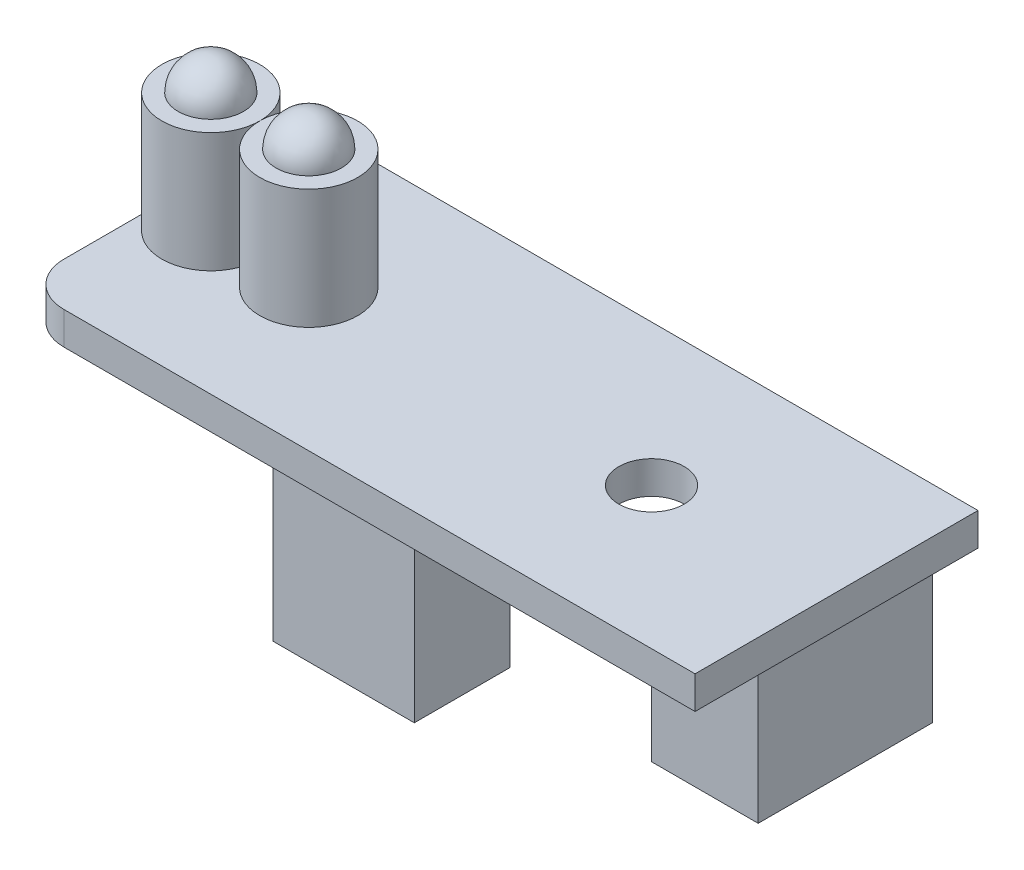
SolidWorks part; units mm, degrees
ref_plane "前视基准面" through (0, 0, 0) normal (0, 0, 1) x (1, 0, 0)
ref_plane "上视基准面" through (0, 0, 0) normal (0, 1, 0) x (1, 0, 0)
ref_plane "右视基准面" through (0, 0, 0) normal (1, 0, 0) x (0, 0, -1)
sketch "草图1" plane through (0, 0, 0) normal (0, 1, 0) x (1, 0, 0)
  line L1 (-15.5, 6.5) -> (15.5, 6.5)
  line L2 (-15.5, 6.5) -> (-15.5, -6.5)
  line L3 (-15.5, -6.5) -> (15.5, -6.5)
  line L4 (15.5, 6.5) -> (15.5, -6.5)
  line L5 (-15.5, 6.5) -> (15.5, -6.5) construction
  line L6 (-15.5, -6.5) -> (15.5, 6.5) construction
  point P0 (0, 0)
extrude "凸台-拉伸1" add sketch "草图1" along normal blind 1.5
fillet "圆角1" radius 2 2 edges at (-15.5, 0.75, 6.5) (-15.5, 0.75, -6.5)
sketch "草图2" plane through (0, 1.5, 0) normal (0, 1, 0) x (1, 0, 0)
  line L0 (-15.5, 0) -> (15.5, 0) construction
  line L1 (-15.5, 4.5) -> (-15.5, -4.5) construction
  line L2 (15.5, -6.5) -> (15.5, 6.5) construction
  circle A0 centre (-13.25, 0) radius 2.25
  circle A1 centre (-8.75, 0) radius 2.25
extrude "凸台-拉伸3" add sketch "草图2" along normal blind 5.5 separate body contours A0 L0 | L0 A0 | L0 A1 | A1 L0
sketch "草图3" plane through (0, 7, 0) normal (0, 1, 0) x (1, 0, 0)
  line L0 (-13.25, 1.5) -> (-13.25, -1.5)
  arc A0 (-13.25, 1.5) -> (-13.25, -1.5) centre (-13.25, 0) ccw
revolve "旋转1" add sketch "草图3" angle 360 about L0
sketch "草图4" plane through (0, 7, 0) normal (0, 1, 0) x (1, 0, 0)
  line L0 (-8.75, 1.5) -> (-8.75, -1.5)
  arc A0 (-8.75, 1.5) -> (-8.75, -1.5) centre (-8.75, 0) ccw
revolve "旋转2" add sketch "草图4" angle 360 about L0
sketch "草图5" plane through (0, 0, 0) normal (0, -1, 0) x (-1, 0, 0)
  line L0 (-15.5, -6.5) -> (-15.5, 6.5) construction
  circle A0 centre (-7, 0) radius 1.5
  dimension "D1" = 8.5
extrude "切除-拉伸1" cut sketch "草图5" against normal blind 5.5
sketch "草图6" plane through (0, 0, 0) normal (0, -1, 0) x (1, 0, 0)
  line L0 (-13.5, 6.5) -> (15.5, 6.5) construction
  line L1 (-4, 2) -> (2.5, 2)
  line L2 (-4, 2) -> (-4, 6.5)
  line L3 (-4, 6.5) -> (2.5, 6.5)
  line L4 (2.5, 2) -> (2.5, 6.5)
  line L5 (-4, 2) -> (2.5, 6.5) construction
  line L6 (-4, 6.5) -> (2.5, 2) construction
  line L7 (-15.5, -4.5) -> (-15.5, 4.5) construction
  point P0 (-0.75, 4.25)
  dimension "D1" = 18
extrude "凸台-拉伸4" add sketch "草图6" along normal blind 7
sketch "草图7" plane through (0, 0, 0) normal (0, -1, 0) x (1, 0, 0)
  line L0 (-15.5, -4.5) -> (-15.5, 4.5) construction
  line L1 (-3, -0.1059) -> (1, -0.1059)
  line L2 (-3, -0.1059) -> (-3, -5.1059)
  line L3 (-3, -5.1059) -> (1, -5.1059)
  line L4 (1, -0.1059) -> (1, -5.1059)
  line L5 (-3, -0.1059) -> (1, -5.1059) construction
  line L6 (-3, -5.1059) -> (1, -0.1059) construction
  point P0 (-1, -2.6059)
  dimension "D1" = 16.5
extrude "凸台-拉伸5" add sketch "草图7" along normal blind 1.5
sketch "草图8" plane through (0, 0, 0) normal (0, -1, 0) x (1, 0, 0)
  line L0 (15.5, 6.5) -> (15.5, -6.5) construction
  line L1 (10.5, 3.5) -> (15.5, 3.5)
  line L2 (10.5, 3.5) -> (10.5, -4.5)
  line L3 (10.5, -4.5) -> (15.5, -4.5)
  line L4 (15.5, 3.5) -> (15.5, -4.5)
  line L5 (10.5, 3.5) -> (15.5, -4.5) construction
  line L6 (10.5, -4.5) -> (15.5, 3.5) construction
  line L7 (15.5, -6.5) -> (-13.5, -6.5) construction
  point P0 (13, -0.5)
  dimension "D1" = 10
extrude "凸台-拉伸6" add sketch "草图8" along normal blind 6
sketch "草图9" plane through (0, -6, 0) normal (0, -1, 0) x (1, 0, 0)
  line L0 (10.5, -0.5) -> (15.5, -0.5) construction
  line L1 (10.5, 3.5) -> (10.5, -4.5) construction
  line L2 (15.5, -4.5) -> (15.5, 3.5) construction
  line L3 (10.5, -4.5) -> (15.5, -4.5) construction
  line L4 (11, 3) -> (15, 3)
  line L5 (11, 3) -> (11, -4)
  line L6 (11, -4) -> (15, -4)
  line L7 (15, 3) -> (15, -4)
  line L8 (11, 3) -> (15, -4) construction
  line L9 (11, -4) -> (15, 3) construction
  point P6 (13, -0.5)
  dimension "D1" = 0.5
  dimension "D2" = 0.5
extrude "切除-拉伸2" cut sketch "草图9" against normal blind 5
sketch "草图10" plane through (0, 0, 6.5) normal (0, 0, 1) x (1, 0, 0)
  line L0 (2.5, -7) -> (2.5, 0)
  line L1 (2.5, 0) -> (-4, 0)
  line L2 (-4, 0) -> (-4, -7)
  line L3 (-4, -7) -> (2.5, -7)
extrude "切除-拉伸3" cut sketch "草图10" against normal blind 0.1
sketch "草图11" plane through (15.5, 0, 0) normal (1, 0, 0) x (0, 0, -1)
  line L0 (4.5, -6) -> (-3.5, -6)
  line L1 (-3.5, -6) -> (-3.5, 0)
  line L2 (-3.5, 0) -> (4.5, 0)
  line L3 (4.5, 0) -> (4.5, -6)
extrude "切除-拉伸4" cut sketch "草图11" against normal blind 0.1
